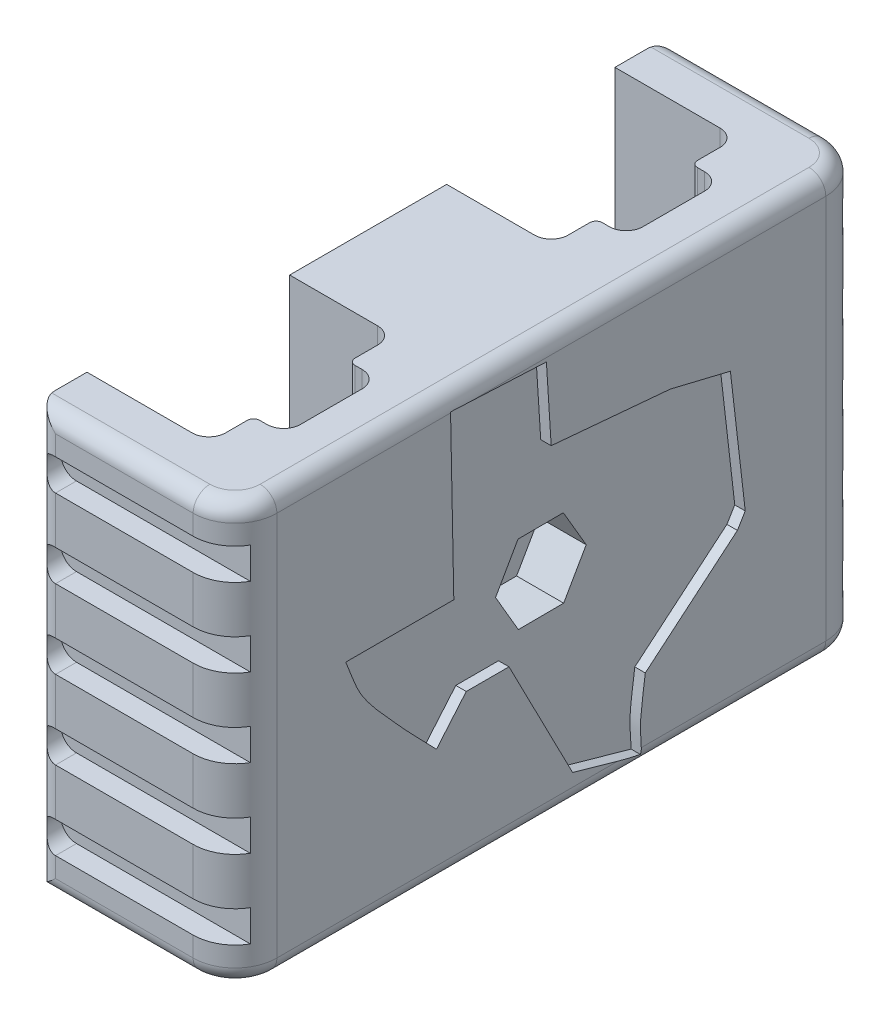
SolidWorks part; units mm, degrees
ref_plane "Front Plane" through (0, 0, 0) normal (0, 0, 1) x (1, 0, 0)
ref_plane "Top Plane" through (0, 0, 0) normal (0, 1, 0) x (1, 0, 0)
ref_plane "Right Plane" through (0, 0, 0) normal (1, 0, 0) x (0, 0, -1)
sketch "Sketch1" plane through (0, 0, 0) normal (0, 1, 0) x (1, 0, 0)
  line L0 (-14.9475, 0) -> (9.3644, 0)
  line L1 (-14.9475, 0) -> (-14.9475, -6.35)
  line L2 (-14.9475, -6.35) -> (-0.1606, -6.35)
  line L3 (-0.1606, -70.4088) -> (-0.1606, -47.9044)
  line L4 (-0.1606, -70.4088) -> (-14.9475, -70.4088)
  line L5 (-14.9475, -70.4088) -> (-14.9475, -76.7588)
  line L6 (-14.9475, -76.7588) -> (9.3644, -76.7588)
  line L7 (9.3644, -76.7588) -> (9.3644, 0)
  line L8 (9.3644, 0) -> (0, 0)
  line L9 (-0.1606, -28.8544) -> (-12.8606, -28.8544)
  line L10 (-12.8606, -28.8544) -> (-12.8606, -47.9044)
  line L11 (-12.8606, -47.9044) -> (-0.1606, -47.9044)
  line L12 (-0.1606, -28.8544) -> (-0.1606, -6.35)
  dimension "D1" = 19.05
  dimension "D2" = 76.7588
  dimension "D3" = 22.5044
  dimension "D4" = 6.35
  dimension "D5" = 9.525
extrude "Boss-Extrude1" add sketch "Sketch1" along normal blind 50.8 contours L12 L9 L10 L11 L3 L4 L5 L6 L7 L0 L1 L2
fillet "Fillet2" radius 5.08 2 edges at (9.3644, 25.4, 76.7588) (9.3644, 25.4, 0)
sketch "Sketch2" plane through (-12.8606, 0, 0) normal (-1, 0, 0) x (0, 0, 1)
  line L0 (33.2994, 4.445) -> (33.2994, 10.795)
  line L1 (33.2994, 10.795) -> (43.4594, 10.795)
  line L2 (43.4594, 10.795) -> (43.4594, 4.445)
  line L3 (33.2994, 15.24) -> (33.2994, 21.59)
  line L4 (33.2994, 21.59) -> (43.4594, 21.59)
  line L5 (43.4594, 21.59) -> (43.4594, 15.24)
  line L6 (33.2994, 4.445) -> (43.4594, 4.445)
  line L7 (33.2994, 15.24) -> (43.4594, 15.24)
  line L12 (33.2994, 29.21) -> (33.2994, 35.56)
  line L13 (33.2994, 35.56) -> (43.4594, 35.56)
  line L14 (43.4594, 35.56) -> (43.4594, 29.21)
  line L15 (33.2994, 29.21) -> (43.4594, 29.21)
  line L16 (33.2994, 40.005) -> (33.2994, 46.355)
  line L17 (33.2994, 46.355) -> (43.4594, 46.355)
  line L18 (43.4594, 46.355) -> (43.4594, 40.005)
  line L19 (33.2994, 40.005) -> (43.4594, 40.005)
  line L20 (28.8544, 50.8) -> (28.8544, 0) construction
  line L21 (47.9044, 50.8) -> (47.9044, 0) construction
  line L22 (28.8544, 50.8) -> (47.9044, 50.8) construction
  line L23 (28.8544, 0) -> (47.9044, 0) construction
  dimension "D1" = 4.445
  dimension "D2" = 4.445
  dimension "D3" = 4.445
  dimension "D4" = 4.445
  dimension "D5" = 4.445
  dimension "D6" = 4.445
  dimension "D7" = 7.62
ref_plane "Plane7" through (-0.1606, 50.8, 6.35) normal (0, -1, 0) x (-1, 0, 0)
fillet "Fillet3" radius 2.54 2 edges at (-14.9475, 25.4, 0) (-14.9475, 25.4, 76.7588)
ref_plane "Plane8" through (-0.1606, 0, 0) normal (-1, 0, 0) x (0, 0, 1)
ref_plane "Plane9" through (9.3644, 0, 0) normal (1, 0, 0) x (0, 0, -1)
fillet "Fillet4" radius 2.032 4 edges at (-0.1606, 25.4, 70.4088) (-0.1606, 25.4, 6.35) (-0.1606, 25.4, 28.8544) (-0.1606, 25.4, 47.9044)
sketch "Sketch4" plane through (9.3644, 0, 0) normal (1, 0, 0) x (0, 0, -1)
  line L0 (-50.6056, 48.8771) -> (-38.978, 48.3179)
  line L1 (-38.978, 48.3179) -> (-38.3961, 39.2254)
  line L2 (-38.3961, 39.2254) -> (-23.9259, 37.9416)
  line L3 (-23.9259, 37.9416) -> (-16.6533, 36.1808)
  line L4 (-16.6533, 36.1808) -> (-14.852, 20.5956)
  line L5 (-14.852, 20.5956) -> (-15.8032, 19.029)
  line L6 (-15.8032, 19.029) -> (-26.9787, 9.6386)
  line L7 (-27.423, 1.2211) -> (-35.7921, 3.5837)
  line L8 (-35.7921, 3.5837) -> (-43.5175, 18.5522)
  line L9 (-43.5175, 18.5522) -> (-48.7017, 18.5522)
  line L10 (-48.7017, 18.5522) -> (-52.3118, 14.2866)
  line L11 (-63.325, 28.9449) -> (-50.2104, 28.9449)
  line L12 (-50.2104, 28.9449) -> (-50.6056, 48.8771)
  spline S0 degree 3 poles (-26.9787, 9.6386) (-27.1707, 8.0056) (-27.4679, 6.3816) (-27.5546, 4.7396) (-27.6164, 3.5676) (-27.4669, 2.3939) (-27.423, 1.2211) knots 0 0 0 0 1 1 1 2 2 2 2
  spline S1 degree 3 poles (-52.3118, 14.2866) (-53.8888, 15.9411) (-55.521, 17.5448) (-57.0428, 19.2503) (-58.5216, 20.9075) (-60.1007, 22.5051) (-61.3085, 24.369) (-62.2149, 25.7679) (-62.6528, 27.4196) (-63.325, 28.9449) knots 0 0 0 0 1 1 1 2 2 2 3 3 3 3
fillet "Fillet5" radius 2.032 10 edges at (7.8765, 50.8, 75.2709) (9.3644, 50.8, 38.3794) (7.8765, 50.8, 1.4879) (-4.0615, 50.8, 0) (-4.0615, 0, 0) (7.8765, 0, 1.4879) (9.3644, 0, 38.3794) (7.8765, 0, 75.2709) (-4.0615, 0, 76.7588) (-4.0615, 50.8, 76.7588)
sketch "Sketch5" plane through (-0.1606, 0, 0) normal (-1, 0, 0) x (0, 0, 1)
  line L0 (26.8224, 50.8) -> (8.382, 50.8) construction
  line L1 (11.8745, 50.8) -> (11.8745, 0)
  line L2 (26.8224, 0) -> (8.382, 0) construction
  line L3 (11.8745, 0) -> (23.4315, 0)
  line L4 (23.4315, 0) -> (23.4315, 50.8)
  line L5 (23.4315, 50.8) -> (11.8745, 50.8)
  line L6 (53.4289, 50.8) -> (53.4289, 0)
  line L7 (68.3768, 50.8) -> (49.9364, 50.8) construction
  line L8 (68.3768, 0) -> (49.9364, 0) construction
  line L9 (53.4289, 0) -> (64.9859, 0)
  line L10 (64.9859, 0) -> (64.9859, 50.8)
  line L11 (64.9859, 50.8) -> (53.4289, 50.8)
  line L14 (6.35, 0) -> (6.35, 50.8) construction
  line L15 (47.9044, 0) -> (47.9044, 50.8) construction
  dimension "D1" = 11.557
  dimension "D2" = 5.5245
  dimension "D3" = 5.5245
extrude "Cut-Extrude4" cut sketch "Sketch5" against normal blind 3.6576
fillet "Fillet6" radius 0.762 4 edges at (-0.1606, 25.4, 64.9859) (-0.1606, 25.4, 53.4289) (-0.1606, 25.4, 23.4315) (-0.1606, 25.4, 11.8745)
fillet "Fillet7" radius 2.032 4 edges at (3.497, 25.4, 64.9859) (3.497, 25.4, 53.4289) (3.497, 25.4, 23.4315) (3.497, 25.4, 11.8745)
extrude "Cut-Extrude5" cut sketch "Sketch4" against normal blind 1.27
sketch "Sketch16" plane through (8.0944, 0, 0) normal (1, 0, 0) x (0, 0, -1)
  line L0 (-47.9044, 50.8) -> (-47.9044, 0) construction
  line L1 (-28.8544, 50.8) -> (-47.9044, 50.8) construction
  line L3 (-32.8802, 25.4237) -> (-35.6503, 30.1743)
  line L4 (-35.6503, 30.1743) -> (-41.1496, 30.1506)
  line L5 (-41.1496, 30.1506) -> (-43.8786, 25.3763)
  line L6 (-43.8786, 25.3763) -> (-41.1085, 20.6257)
  line L7 (-41.1085, 20.6257) -> (-35.6092, 20.6494)
  line L8 (-35.6092, 20.6494) -> (-32.8802, 25.4237)
  circle A0 centre (-38.3794, 25.4) radius 4.7625 construction
  point P0 (-38.3794, 25.4)
  dimension "D1" = 9.525
  dimension "D2" = 25.4
  dimension "D3" = 9.525
extrude "Cut-Extrude6" cut sketch "Sketch16" against normal blind 5.715
hole_wizard "#10 (0.1935) Diameter Hole1" positions "Sketch18" profile "Sketch17" hole size "#10" standard "ANSI Inch"
sketch "Sketch18" plane through (2.3794, 0, 0) normal (1, 0, 0) x (0, 0, -1)
  line L0 (-28.8544, 50.8) -> (-28.8544, 0) construction
  line L1 (-28.8544, 50.8) -> (-47.9044, 50.8) construction
  point P0 (-38.3794, 25.4)
  dimension "D1" = 9.525
  dimension "D2" = 25.4
sketch "Sketch17" plane through (2.3794, 25.4, 38.3794) normal (0, 1, 0) x (0, 0, -1)
  line L0 (0, 0) -> (0, 26.8766)
  line L1 (0, 26.8766) -> (2.4574, 25.4)
  line L2 (2.4574, 25.4) -> (2.4574, 0)
  line L5 (2.4574, 0) -> (0, 0)
  line L10 (0, 26.8766) -> (-2.4575, 25.4) construction
  line L11 (0, -6.35) -> (0, 107.95) construction
  dimension "Hole Dia." = 4.9149
  dimension "Hole Depth" = 25.4
  dimension "Drill Angle" = 118
extrude "Cut-Extrude7" cut sketch "Sketch2" against normal blind 12.7
ref_plane "Plane10" through (0, 0, 38.1) normal (0, 0, -1) x (-1, 0, 0)
sketch "Sketch19" plane through (0, 0, 76.7588) normal (0, 0, 1) x (1, 0, 0)
  line L0 (-12.4075, 44.45) -> (9.3644, 44.45) construction
  line L3 (-12.4075, 48.768) -> (-12.4075, 2.032) construction
  line L4 (9.3644, -25.7048) -> (9.3644, 25.7048) construction
  line L5 (-12.4075, 46.355) -> (9.3644, 46.355)
  line L6 (-12.4075, 42.545) -> (9.3644, 42.545)
  line L8 (-12.4075, 34.925) -> (9.3644, 34.925) construction
  line L9 (-12.4075, 36.83) -> (9.3644, 36.83)
  line L10 (-12.4075, 33.02) -> (9.3644, 33.02)
  line L11 (-12.4075, 25.4) -> (9.3644, 25.4) construction
  line L12 (-12.4075, 27.305) -> (9.3644, 27.305)
  line L13 (-12.4075, 23.495) -> (9.3644, 23.495)
  line L14 (-12.4075, 15.875) -> (9.3644, 15.875) construction
  line L15 (-12.4075, 17.78) -> (9.3644, 17.78)
  line L16 (-12.4075, 13.97) -> (9.3644, 13.97)
  line L17 (-12.4075, 6.35) -> (9.3644, 6.35) construction
  line L18 (-12.4075, 8.255) -> (9.3644, 8.255)
  line L19 (-12.4075, 4.445) -> (9.3644, 4.445)
  line L20 (-15.7583, 50.8) -> (15.4371, 50.8) construction
  arc A0 (-12.4075, 46.355) -> (-12.4075, 42.545) centre (-12.4075, 44.45) ccw
  arc A1 (9.3644, 42.545) -> (9.3644, 46.355) centre (9.3644, 44.45) ccw
  arc A2 (-12.4075, 36.83) -> (-12.4075, 33.02) centre (-12.4075, 34.925) ccw
  arc A3 (9.3644, 33.02) -> (9.3644, 36.83) centre (9.3644, 34.925) ccw
  arc A4 (-12.4075, 27.305) -> (-12.4075, 23.495) centre (-12.4075, 25.4) ccw
  arc A5 (9.3644, 23.495) -> (9.3644, 27.305) centre (9.3644, 25.4) ccw
  arc A6 (-12.4075, 17.78) -> (-12.4075, 13.97) centre (-12.4075, 15.875) ccw
  arc A7 (9.3644, 13.97) -> (9.3644, 17.78) centre (9.3644, 15.875) ccw
  arc A8 (-12.4075, 8.255) -> (-12.4075, 4.445) centre (-12.4075, 6.35) ccw
  arc A9 (9.3644, 4.445) -> (9.3644, 8.255) centre (9.3644, 6.35) ccw
  point P6 (-1.5215, 44.45)
  point P11 (-1.5215, 34.925)
  point P18 (-1.5215, 25.4)
  point P25 (-1.5215, 15.875)
  point P32 (-1.5215, 6.35)
  dimension "D1" = 6.35
  dimension "D2" = 9.525
  dimension "D3" = 9.525
  dimension "D4" = 9.525
  dimension "D5" = 9.525
  dimension "D6" = 3.81
  dimension "D7" = 3.81
  dimension "D8" = 3.81
  dimension "D9" = 3.81
  dimension "D10" = 3.81
extrude "Cut-Extrude8" cut sketch "Sketch19" against normal blind 2.54
mirror "Mirror1" about plane through (0, 0, 38.1) normal (0, 0, -1) of "Cut-Extrude8"
